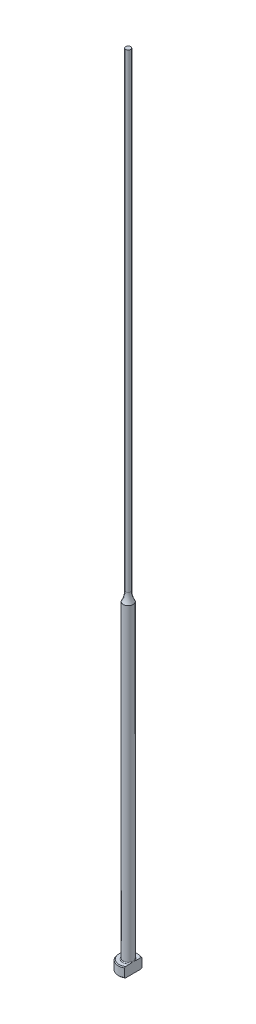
SolidWorks part; units mm, degrees
ref_plane "Front Plane" through (0, 0, 0) normal (0, 0, 1) x (1, 0, 0)
ref_plane "Top Plane" through (0, 0, 0) normal (0, 1, 0) x (1, 0, 0)
ref_plane "Right Plane" through (0, 0, 0) normal (1, 0, 0) x (0, 0, -1)
sketch "Sketch1" plane through (0, 0, 0) normal (0, 0, 1) x (1, 0, 0)
  line L0 (0, 259.9588) -> (0, -15.1925) construction
  line L1 (0, 0) -> (-3.175, 0)
  line L2 (-3.175, 0) -> (-3.175, 3.175)
  line L3 (-3.175, 3.175) -> (-1.5875, 3.175)
  line L4 (-0.7937, 104.6742) -> (-0.7937, 254)
  line L5 (-0.7937, 254) -> (0, 254)
  line L6 (0, 254) -> (0, 0)
  line L7 (-1.5875, 3.175) -> (-1.5875, 101.6)
  arc A0 (-1.5875, 101.6) -> (-0.7937, 104.6742) centre (-7.1437, 104.6742) ccw
  point P13 (-1.5875, 0)
  dimension "D1" = 6.35
  dimension "L" = 254
  dimension "D2" = 3.175
  dimension "H" = 6.35
  dimension "T" = 3.175
  dimension "D" = 1.5875
  dimension "S" = 101.6
revolve "Revolve1" add sketch "Sketch1" angle 360 about L0
chamfer "Chamfer1" distance 0.254 angle 45 2 edges at (0, 3.175, 3.175) (0, 0, 3.175)
fillet "Fillet1" radius 0.254 1 edges at (0, 3.175, 1.5875)
sketch "Sketch2" plane through (0, 0, 0) normal (0, 1, 0) x (1, 0, 0)
  line L0 (1.5875, -2.7496) -> (1.5875, 2.7496)
  circle A0 centre (0, 0) radius 3.175 construction
  arc A2 (1.5875, -2.7496) -> (1.5875, 2.7496) centre (0, 0) ccw
  circle A3 centre (0, 0) radius 3.175 construction
  circle A4 centre (0, 0) radius 1.5875 construction
extrude "Key Head" cut sketch "Sketch2" along normal up to next
